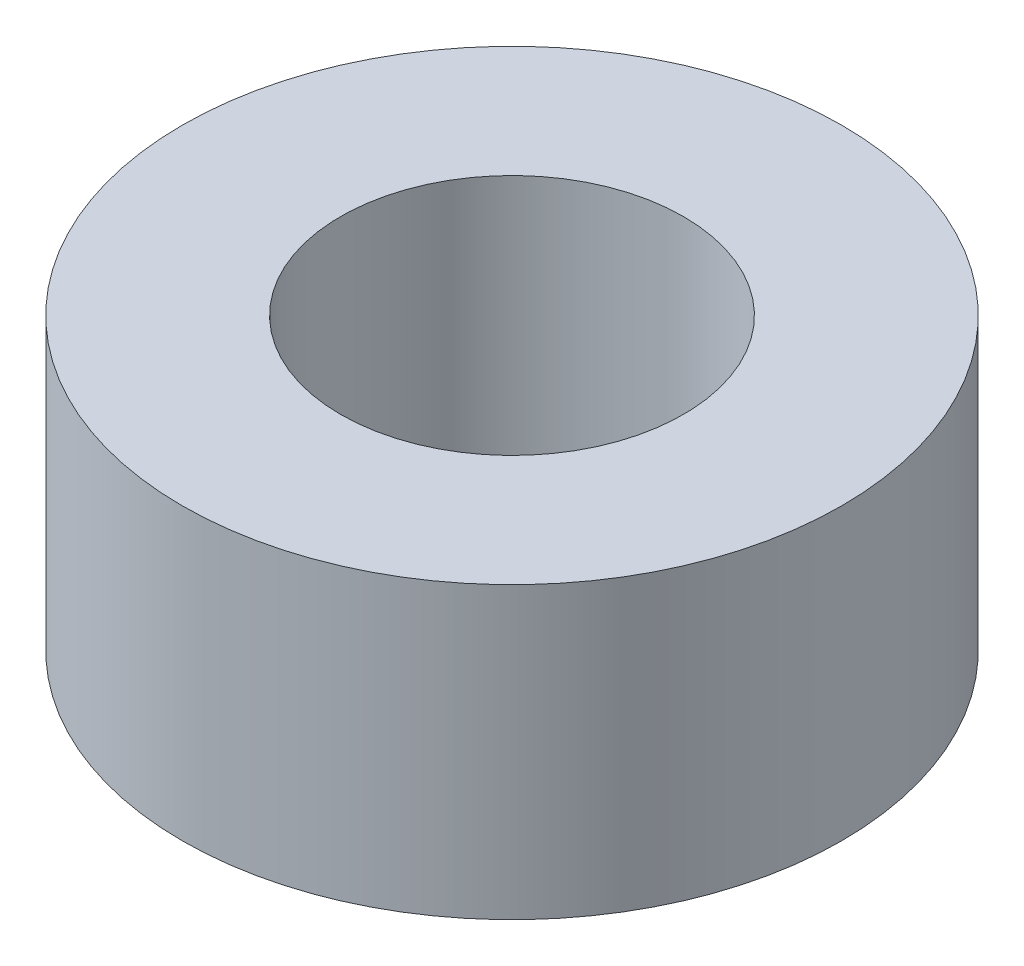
SolidWorks part; units mm, degrees
ref_plane "Front" through (0, 0, 0) normal (0, 0, 1) x (1, 0, 0)
ref_plane "Top" through (0, 0, 0) normal (0, 1, 0) x (1, 0, 0)
ref_plane "Right" through (0, 0, 0) normal (1, 0, 0) x (0, 0, -1)
sketch "Sketch1" plane through (0, 0, 0) normal (0, 1, 0) x (1, 0, 0)
  circle A0 centre (0, 0) radius 3.175
  circle A1 centre (0, 0) radius 1.651
  dimension "D1" = 6.35
  dimension "D2" = 3.302
extrude "Extrude1" add sketch "Sketch1" along normal mid plane 2.794
